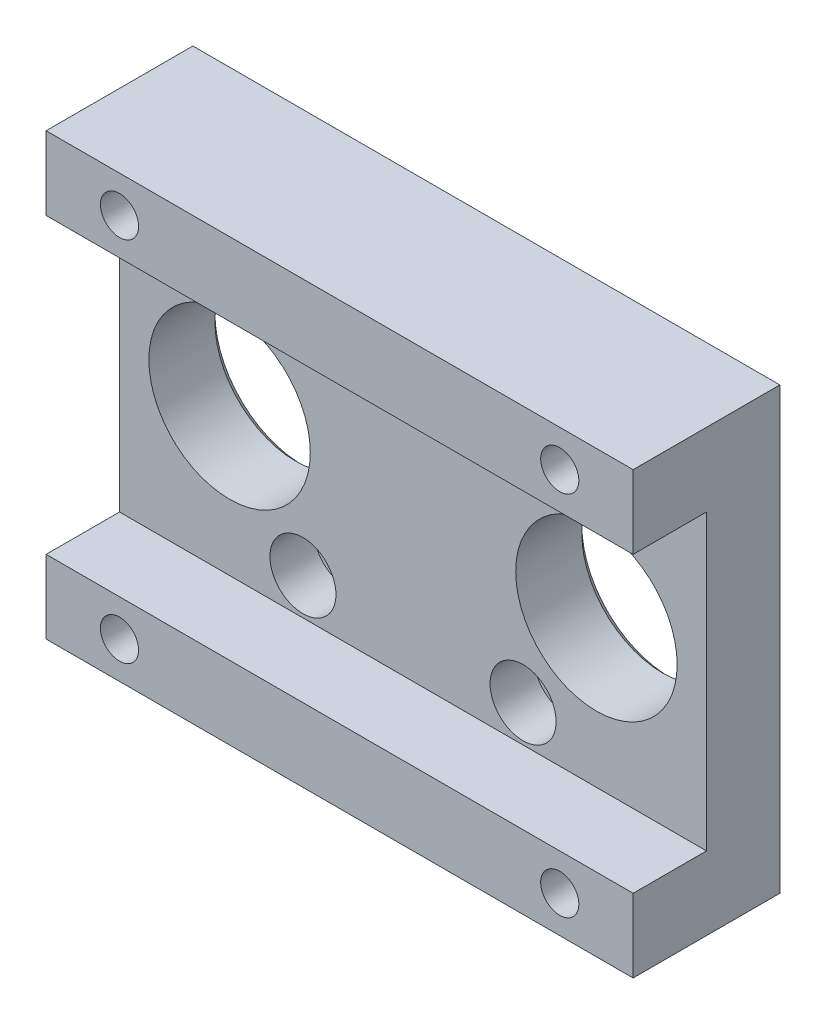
SolidWorks part; units mm, degrees
ref_plane "Ebene vorne" through (0, 0, 0) normal (0, 0, 1) x (1, 0, 0)
ref_plane "Ebene oben" through (0, 0, 0) normal (0, 1, 0) x (1, 0, 0)
ref_plane "Ebene rechts" through (0, 0, 0) normal (1, 0, 0) x (0, 0, -1)
sketch "Skizze1" plane through (0, 0, 0) normal (0, 0, 1) x (1, 0, 0)
  line L1 (-40, 30) -> (40, 30)
  line L2 (-40, 30) -> (-40, -30)
  line L3 (-40, -30) -> (40, -30)
  line L4 (40, 30) -> (40, -30)
  line L5 (-40, 30) -> (40, -30) construction
  line L6 (-40, -30) -> (40, 30) construction
  point P0 (0, 0)
  dimension "D1" = 80
  dimension "D2" = 60
extrude "Aufsatz-Linear austragen1" add sketch "Skizze1" along normal blind 10
sketch "Skizze2" plane through (0, 0, 10) normal (0, 0, 1) x (1, 0, 0)
  line L0 (40, -30) -> (40, 30) construction
  line L1 (-40, 30) -> (40, 30)
  line L2 (-40, 30) -> (-40, 20)
  line L3 (-40, 20) -> (40, 20)
  line L4 (40, 30) -> (40, 20)
  line L5 (-40, 30) -> (-40, -30) construction
  line L6 (40, -30) -> (-40, -30)
  line L7 (40, -30) -> (40, -20)
  line L8 (40, -20) -> (-40, -20)
  line L9 (-40, -30) -> (-40, -20)
  dimension "D1" = 10
  dimension "D2" = 10
extrude "Aufsatz-Linear austragen2" add sketch "Skizze2" along normal blind 10
sketch "Skizze5" plane through (0, 0, 20) normal (0, 0, 1) x (1, 0, 0)
  line L0 (-40, 20) -> (40, 20) construction
  line L1 (-40, -30) -> (40, -30) construction
  line L2 (40, -30) -> (40, -20) construction
  line L3 (40, 20) -> (40, 30) construction
  line L4 (-40, 30) -> (-40, 20) construction
  line L5 (-40, -20) -> (-40, -30) construction
  circle A0 centre (30, 25) radius 2.6
  circle A1 centre (-30, 25) radius 2.6
  circle A2 centre (-30, -25) radius 2.6
  circle A3 centre (30, -25) radius 2.6
  dimension "D1" = 5.2
  dimension "D2" = 5.2
  dimension "D3" = 5.2
  dimension "D4" = 5.2
  dimension "D5" = 5
  dimension "D6" = 5
  dimension "D7" = 5
  dimension "D8" = 5
  dimension "D9" = 10
  dimension "D10" = 10
  dimension "D11" = 10
  dimension "D12" = 10
extrude "Schnitt-Linear austragen3" cut sketch "Skizze5" against normal blind 20
sketch "Skizze6" plane through (0, 0, 10) normal (0, 0, 1) x (1, 0, 0)
  line L0 (40, -20) -> (40, 20) construction
  line L1 (-40, 20) -> (-40, -20) construction
  line L2 (-40, 20) -> (40, 20) construction
  line L3 (40, -20) -> (-40, -20) construction
  circle A0 centre (-25, 0) radius 11
  circle A1 centre (25, 0) radius 11
  dimension "D1" = 22
  dimension "D2" = 22
  dimension "D3" = 15
  dimension "D4" = 15
  dimension "D5" = 20
  dimension "D6" = 20
extrude "Schnitt-Linear austragen4" cut sketch "Skizze6" against normal blind 12.2
chamfer "Fase1" distance 1 angle 45 2 edges at (36, 0, 0) (-14, 0, 0)
sketch "Skizze7" plane through (0, 0, 0) normal (0, 0, -1) x (-1, 0, 0)
  circle A0 centre (-30, 25) radius 4.5
  circle A1 centre (30, 25) radius 4.5
  circle A2 centre (30, -25) radius 4.5
  circle A3 centre (-30, -25) radius 4.5
  dimension "D1" = 9
  dimension "D2" = 9
  dimension "D3" = 9
  dimension "D4" = 9
extrude "Schnitt-Linear austragen5" cut sketch "Skizze7" against normal blind 5.3
sketch "Skizze8" plane through (0, 0, 0) normal (0, 0, -1) x (-1, 0, 0)
  line L1 (-15, 15) -> (15, 15)
  line L2 (-15, 15) -> (-15, -15)
  line L3 (-15, -15) -> (15, -15)
  line L4 (15, 15) -> (15, -15)
  line L5 (-15, 15) -> (15, -15) construction
  line L6 (-15, -15) -> (15, 15) construction
  circle A0 centre (-15, 15) radius 2.6
  circle A1 centre (15, 15) radius 2.6
  circle A2 centre (15, -15) radius 2.6
  circle A3 centre (-15, -15) radius 2.6
  point P0 (0, 0)
  dimension "D3" = 5.2
  dimension "D1" = 30
  dimension "D2" = 30
extrude "Schnitt-Linear austragen6" cut sketch "Skizze8" against normal blind 10 contours A0 | A1 | A2 | A3
sketch "Skizze9" plane through (0, 0, 10) normal (0, 0, 1) x (1, 0, 0)
  circle A0 centre (15, 15) radius 4.5
  circle A1 centre (-15, 15) radius 4.5
  circle A2 centre (-15, -15) radius 4.5
  circle A3 centre (15, -15) radius 4.5
extrude "Schnitt-Linear austragen7" cut sketch "Skizze9" against normal blind 6
